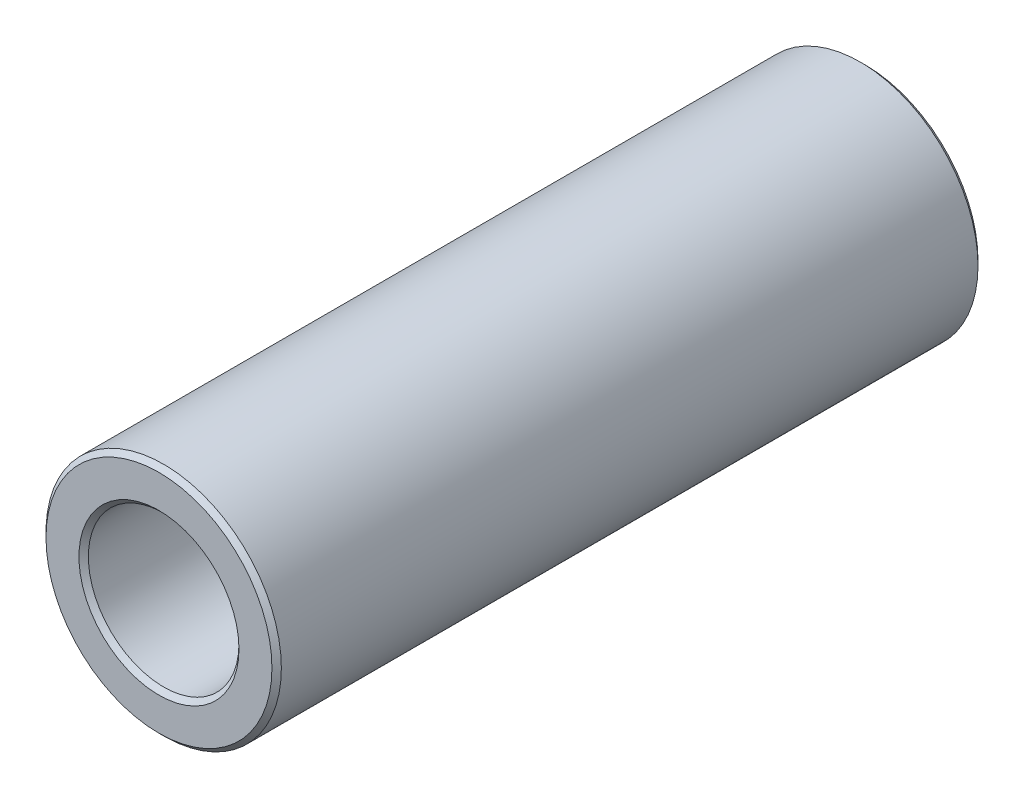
SolidWorks part; units mm, degrees
ref_plane "Front Plane" through (0, 0, 0) normal (0, 0, 1) x (1, 0, 0)
ref_plane "Top Plane" through (0, 0, 0) normal (0, 1, 0) x (1, 0, 0)
ref_plane "Right Plane" through (0, 0, 0) normal (1, 0, 0) x (0, 0, -1)
sketch "Sketch1" plane through (0, 0, 0) normal (0, 0, 1) x (1, 0, 0)
  circle A0 centre (0, 0) radius 5
  circle A1 centre (0, 0) radius 3.2
  dimension "D1" = 10
  dimension "D2" = 6.4
extrude "Boss-Extrude2" add sketch "Sketch1" along normal mid plane 30
chamfer "Chamfer3" distance 0.2 angle 45 4 edges at (5, 0, 15) (5, 0, -15) (3.2, 0, -15) (3.2, 0, 15)
